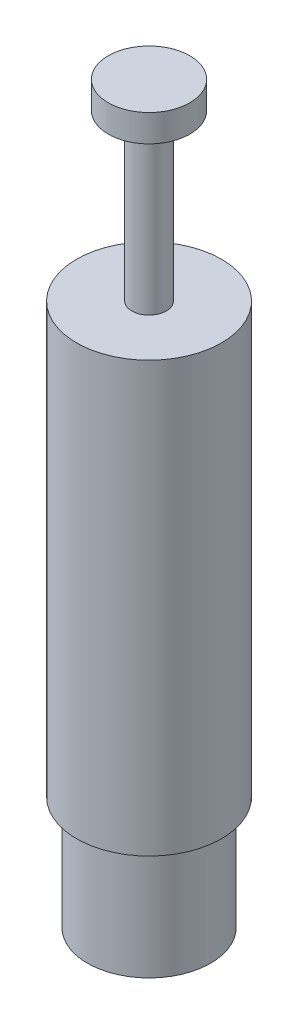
SolidWorks part; units mm, degrees
ref_plane "Front Plane" through (0, 0, 0) normal (0, 0, 1) x (1, 0, 0)
ref_plane "Top Plane" through (0, 0, 0) normal (0, 1, 0) x (1, 0, 0)
ref_plane "Right Plane" through (0, 0, 0) normal (1, 0, 0) x (0, 0, -1)
sketch "Sketch1" plane through (0, 0, 0) normal (0, 0, 1) x (1, 0, 0)
  line L0 (0, 0) -> (0, 17.5016) construction
  line L1 (0, 0) -> (3.4, 0)
  line L2 (3.4, 0) -> (3.4, 6.25)
  line L3 (3.4, 6.25) -> (4, 6.25)
  line L4 (4, 6.25) -> (4, 29.95)
  line L5 (4, 29.95) -> (0.95, 29.95)
  line L6 (0.95, 29.95) -> (0.95, 39.05)
  line L7 (0.95, 39.05) -> (2.25, 39.05)
  line L8 (2.25, 39.05) -> (2.25, 40.55)
  line L9 (2.25, 40.55) -> (0, 40.55)
  line L10 (0, 40.55) -> (0, 0)
  dimension "D1" = 6.8
  dimension "D2" = 8
  dimension "D3" = 6.25
  dimension "D4" = 23.7
  dimension "D5" = 1.9
  dimension "D6" = 9.1
  dimension "D7" = 4.5
  dimension "D8" = 1.5
revolve "Revolve1" add sketch "Sketch1" angle 360 about L0
